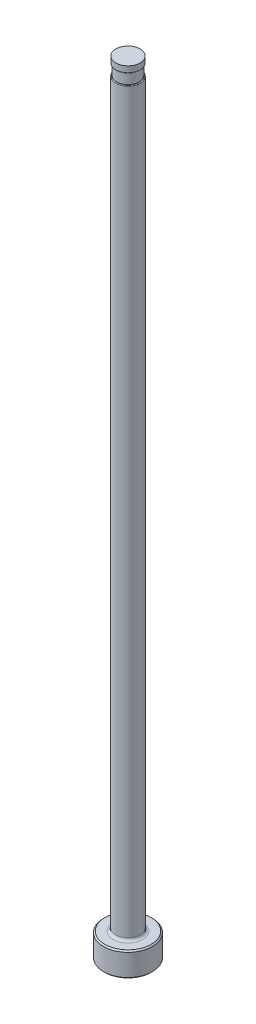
SolidWorks part; units mm, degrees
ref_plane "Front Plane" through (0, 0, 0) normal (0, 0, 1) x (1, 0, 0)
ref_plane "Top Plane" through (0, 0, 0) normal (0, 1, 0) x (1, 0, 0)
ref_plane "Right Plane" through (0, 0, 0) normal (1, 0, 0) x (0, 0, -1)
other "Configuration Table"
sketch "Sketch1" plane through (0, 0, 0) normal (0, 0, 1) x (1, 0, 0)
  line L0 (0, 259.9588) -> (0, -15.1925) construction
  line L1 (0, 0) -> (-4.7625, 0)
  line L2 (-4.7625, 0) -> (-4.7625, 4.7498)
  line L3 (-4.7625, 4.7498) -> (-2.3812, 4.7498)
  line L4 (-2.3812, 4.7498) -> (-2.3812, 152.4)
  line L5 (-2.3812, 152.4) -> (0, 152.4)
  line L6 (0, 152.4) -> (0, 0)
  dimension "L" = 152.4
  dimension "H" = 9.525
  dimension "T" = 4.7498
  dimension "D" = 4.7625
revolve "Revolve1" add sketch "Sketch1" angle 360 about L0
chamfer "Chamfer1" distance 0.254 angle 45 2 edges at (0, 4.7498, 4.7625) (0, 0, 4.7625)
fillet "Fillet1" radius 0.508 1 edges at (0, 4.7498, 2.3812)
sketch "Sketch2" plane through (0, 0, 0) normal (0, 0, 1) x (1, 0, 0)
  line L0 (-2.3812, 152.4) -> (-2.3812, 5.2578) construction
  line L1 (-2.3812, 151.13) -> (-2.178, 151.13)
  line L2 (-2.3812, 151.13) -> (-2.3812, 149.098)
  line L3 (-2.3812, 149.098) -> (-2.178, 149.098)
  line L4 (-2.178, 151.13) -> (-2.178, 149.098)
  line L5 (2.3812, 152.4) -> (-2.3812, 152.4) construction
  line L6 (0, 153.4483) -> (0, 147.3282) construction
  dimension "D1" = 2.032
  dimension "N" = 1.27
  dimension "FD" = 0.2032
  dimension "D3" = 4.3561
revolve "Vent Relief" cut sketch "Sketch2" angle 360 about L6
sketch "Sketch3" plane through (0, 0, 0) normal (0, 0, 1) x (1, 0, 0)
  line L0 (-2.178, 150.114) -> (-2.178, 86.614)
  line L1 (-2.178, 151.13) -> (-2.178, 149.098) construction
  line L2 (-2.3812, 149.098) -> (-2.3812, 5.2578) construction
  line L3 (-2.3812, 85.4964) -> (-2.3812, 150.114)
  line L4 (-2.3812, 150.114) -> (-2.178, 150.114)
  arc A0 (-2.178, 86.614) -> (-2.3812, 85.4964) centre (-5.353, 86.614) cw
  dimension "D1" = 3.175
  dimension "D2" = 63.5
extrude "D-Slot" cut sketch "Sketch3" against normal through all both and the other way through all
sketch "Sketch5" plane through (0, 0, 0) normal (0, 0, 1) x (1, 0, 0)
  line L0 (-2.3812, 151.13) -> (2.3812, 151.13) construction
  line L1 (-2.3812, 152.4) -> (-2.3685, 152.4)
  line L2 (-2.3812, 152.4) -> (-2.3812, 151.13)
  line L3 (-2.3812, 151.13) -> (-2.3685, 151.13)
  line L4 (-2.3685, 152.4) -> (-2.3685, 151.13)
  line L5 (0, 152.6877) -> (0, 150.5771) construction
  dimension "VP" = 0.0127
revolve "Vent Diameter" cut sketch "Sketch5" angle 360 about L5
fillet "Fillet2" radius 0.127 2 edges at (2.3812, 149.098, 0) (0, 151.13, 2.3685)
sketch "Pocket Sketch" plane through (0, 0, 0) normal (0, 0, 1) x (1, 0, 0)
  line L0 (-5.1594, 0) -> (-5.1594, 4.7752)
  line L1 (-5.1594, 4.7752) -> (-3.3417, 4.7752)
  line L2 (-2.5797, 5.5372) -> (-2.5797, 22.225)
  line L3 (-2.5797, 22.225) -> (0, 22.225)
  line L4 (0, 22.225) -> (0, 0)
  line L5 (0, 0) -> (-5.1594, 0)
  line L6 (0, 12.6104) -> (0, -2.4989) construction
  line L7 (-4.7625, 4.4958) -> (-4.7625, 0.254) construction
  line L8 (4.5085, 4.7498) -> (-4.5085, 4.7498) construction
  line L9 (-2.3812, 85.4964) -> (-2.3812, 5.2578) construction
  line L10 (-3.3417, 4.7752) -> (-2.5797, 5.5372)
  point P3 (-2.5797, 4.7752)
  dimension "D1" = 10.3187
  dimension "D2" = 0.3969
  dimension "D3" = 0.0254
  dimension "D4" = 0.1984
  dimension "D5" = 5.1594
  dimension "D6" = 22.225
